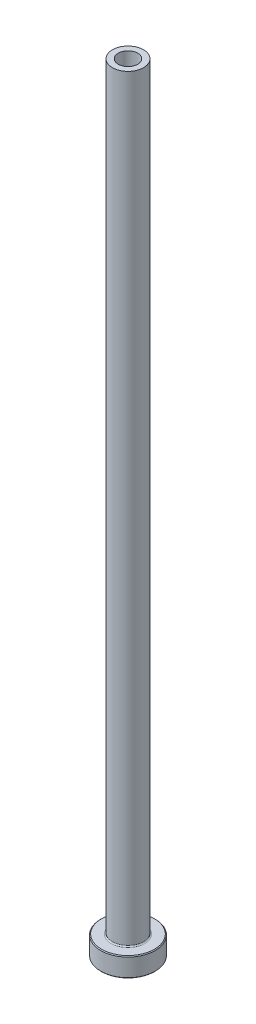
SolidWorks part; units mm, degrees
ref_plane "Front Plane" through (0, 0, 0) normal (0, 0, 1) x (1, 0, 0)
ref_plane "Top Plane" through (0, 0, 0) normal (0, 1, 0) x (1, 0, 0)
ref_plane "Right Plane" through (0, 0, 0) normal (1, 0, 0) x (0, 0, -1)
sketch "Sketch1" plane through (0, 0, 0) normal (0, 0, 1) x (1, 0, 0)
  line L0 (-2.5, 200) -> (-4, 200)
  line L1 (-4, 200) -> (-4, 5)
  line L2 (-4, 5) -> (-7, 5)
  line L3 (-7, 5) -> (-7, 0)
  line L4 (7.7, 0) -> (-7.7, 0) construction
  line L5 (-7, 0) -> (-2.75, 0)
  line L6 (-2.5, 155) -> (-2.5, 200)
  line L7 (0, 92.1877) -> (0, -15.5353) construction
  line L8 (0, -7.7) -> (0, 7.7) construction
  line L9 (-2.5, 155) -> (-2.75, 143)
  line L10 (-2.75, 143) -> (-2.75, 0)
  dimension "D1" = 0.25
  dimension "ID" = 5
  dimension "OD" = 8
  dimension "L" = 200
  dimension "H" = 14
  dimension "T" = 5
  dimension "N" = 45
  dimension "D2" = 12
revolve "Revolve1" add sketch "Sketch1" angle 360 about L7
fillet "Fillet1" radius 0.3 1 edges at (0, 5, 4)
chamfer "Chamfer1" distance 0.2 angle 45 2 edges at (0, 5, 7) (0, 0, 7)
chamfer "Chamfer3" distance 0.5 angle 45 1 edges at (0, 0, 2.75)
